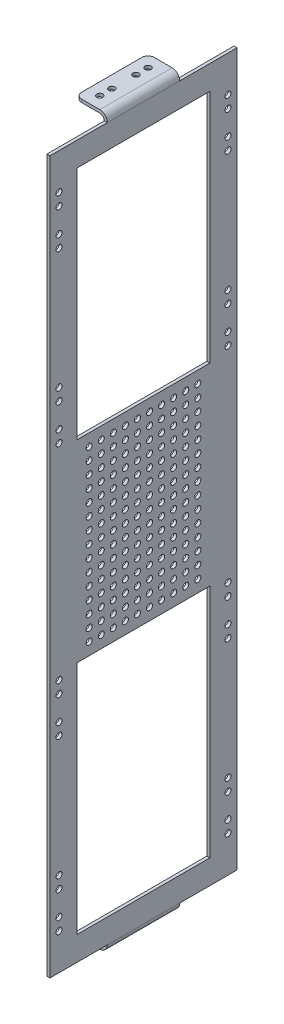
SolidWorks part; units mm, degrees
ref_plane "Front Plane" through (0, 0, 0) normal (0, 0, 1) x (1, 0, 0)
ref_plane "Top Plane" through (0, 0, 0) normal (0, 1, 0) x (1, 0, 0)
ref_plane "Right Plane" through (0, 0, 0) normal (1, 0, 0) x (0, 0, -1)
sketch "Sketch1" plane through (0, 0, 0) normal (1, 0, 0) x (0, 0, -1)
  line L1 (0, 0) -> (95.25, 0)
  line L2 (0, 0) -> (0, 374.65)
  line L3 (0, 374.65) -> (95.25, 374.65)
  line L4 (95.25, 0) -> (95.25, 374.65)
  dimension "D1" = 95.25
  dimension "D2" = 374.65
extrude "MainPlateExtrude" add sketch "Sketch1" along normal blind 1.5875
sketch "Sketch4" plane through (0, 0, 0) normal (-1, 0, 0) x (0, 0, 1)
  line L0 (-82.55, 12.7) -> (-82.55, 361.95)
  line L1 (-95.25, 0) -> (0, 0) construction
  line L2 (-95.25, 0) -> (-95.25, 374.65) construction
  line L3 (-95.25, 374.65) -> (0, 374.65) construction
  line L4 (0, 0) -> (0, 374.65) construction
  line L5 (-82.55, 361.95) -> (-12.7, 361.95)
  line L6 (-12.7, 12.7) -> (-12.7, 361.95)
  line L7 (-82.55, 12.7) -> (-12.7, 12.7)
  dimension "D1" = 12.7
extrude "WallOpening" cut sketch "Sketch4" against normal blind 1.5875
sketch "Sketch5" plane through (0, 0, 0) normal (-1, 0, 0) x (0, 0, 1)
  line L0 (-95.25, 187.325) -> (0, 187.325) construction
  line L1 (-95.25, 0) -> (-95.25, 374.65) construction
  line L2 (0, 374.65) -> (0, 0) construction
  line L3 (-82.55, 361.95) -> (-82.55, 12.7) construction
  line L4 (-82.55, 238.125) -> (-12.7, 238.125)
  line L5 (-82.55, 238.125) -> (-82.55, 136.525)
  line L6 (-82.55, 136.525) -> (-12.7, 136.525)
  line L7 (-12.7, 238.125) -> (-12.7, 136.525)
  line L8 (-12.7, 12.7) -> (-12.7, 361.95) construction
  circle A0 centre (-76.2, 231.775) radius 1.5875
  circle A1 centre (-69.85, 231.775) radius 1.5875
  circle A2 centre (-63.5, 231.775) radius 1.5875
  circle A3 centre (-57.15, 231.775) radius 1.5875
  circle A4 centre (-50.8, 231.775) radius 1.5875
  circle A5 centre (-44.45, 231.775) radius 1.5875
  circle A6 centre (-38.1, 231.775) radius 1.5875
  circle A7 centre (-31.75, 231.775) radius 1.5875
  circle A8 centre (-25.4, 231.775) radius 1.5875
  circle A9 centre (-19.05, 231.775) radius 1.5875
  circle A10 centre (-69.85, 225.425) radius 1.5875
  circle A11 centre (-63.5, 225.425) radius 1.5875
  circle A12 centre (-57.15, 225.425) radius 1.5875
  circle A13 centre (-50.8, 225.425) radius 1.5875
  circle A14 centre (-44.45, 225.425) radius 1.5875
  circle A15 centre (-38.1, 225.425) radius 1.5875
  circle A16 centre (-31.75, 225.425) radius 1.5875
  circle A17 centre (-25.4, 225.425) radius 1.5875
  circle A18 centre (-19.05, 225.425) radius 1.5875
  circle A19 centre (-69.85, 219.075) radius 1.5875
  circle A20 centre (-63.5, 219.075) radius 1.5875
  circle A21 centre (-57.15, 219.075) radius 1.5875
  circle A22 centre (-50.8, 219.075) radius 1.5875
  circle A23 centre (-44.45, 219.075) radius 1.5875
  circle A24 centre (-38.1, 219.075) radius 1.5875
  circle A25 centre (-31.75, 219.075) radius 1.5875
  circle A26 centre (-25.4, 219.075) radius 1.5875
  circle A27 centre (-19.05, 219.075) radius 1.5875
  circle A28 centre (-69.85, 212.725) radius 1.5875
  circle A29 centre (-63.5, 212.725) radius 1.5875
  circle A30 centre (-57.15, 212.725) radius 1.5875
  circle A31 centre (-50.8, 212.725) radius 1.5875
  circle A32 centre (-44.45, 212.725) radius 1.5875
  circle A33 centre (-38.1, 212.725) radius 1.5875
  circle A34 centre (-31.75, 212.725) radius 1.5875
  circle A35 centre (-25.4, 212.725) radius 1.5875
  circle A36 centre (-19.05, 212.725) radius 1.5875
  circle A37 centre (-69.85, 206.375) radius 1.5875
  circle A38 centre (-63.5, 206.375) radius 1.5875
  circle A39 centre (-57.15, 206.375) radius 1.5875
  circle A40 centre (-50.8, 206.375) radius 1.5875
  circle A41 centre (-44.45, 206.375) radius 1.5875
  circle A42 centre (-38.1, 206.375) radius 1.5875
  circle A43 centre (-31.75, 206.375) radius 1.5875
  circle A44 centre (-25.4, 206.375) radius 1.5875
  circle A45 centre (-19.05, 206.375) radius 1.5875
  circle A46 centre (-69.85, 200.025) radius 1.5875
  circle A47 centre (-63.5, 200.025) radius 1.5875
  circle A48 centre (-57.15, 200.025) radius 1.5875
  circle A49 centre (-50.8, 200.025) radius 1.5875
  circle A50 centre (-44.45, 200.025) radius 1.5875
  circle A51 centre (-38.1, 200.025) radius 1.5875
  circle A52 centre (-31.75, 200.025) radius 1.5875
  circle A53 centre (-25.4, 200.025) radius 1.5875
  circle A54 centre (-19.05, 200.025) radius 1.5875
  circle A55 centre (-69.85, 193.675) radius 1.5875
  circle A56 centre (-63.5, 193.675) radius 1.5875
  circle A57 centre (-57.15, 193.675) radius 1.5875
  circle A58 centre (-50.8, 193.675) radius 1.5875
  circle A59 centre (-44.45, 193.675) radius 1.5875
  circle A60 centre (-38.1, 193.675) radius 1.5875
  circle A61 centre (-31.75, 193.675) radius 1.5875
  circle A62 centre (-25.4, 193.675) radius 1.5875
  circle A63 centre (-19.05, 193.675) radius 1.5875
  circle A64 centre (-69.85, 187.325) radius 1.5875
  circle A65 centre (-63.5, 187.325) radius 1.5875
  circle A66 centre (-57.15, 187.325) radius 1.5875
  circle A67 centre (-50.8, 187.325) radius 1.5875
  circle A68 centre (-44.45, 187.325) radius 1.5875
  circle A69 centre (-38.1, 187.325) radius 1.5875
  circle A70 centre (-31.75, 187.325) radius 1.5875
  circle A71 centre (-25.4, 187.325) radius 1.5875
  circle A72 centre (-19.05, 187.325) radius 1.5875
  circle A73 centre (-69.85, 180.975) radius 1.5875
  circle A74 centre (-63.5, 180.975) radius 1.5875
  circle A75 centre (-57.15, 180.975) radius 1.5875
  circle A76 centre (-50.8, 180.975) radius 1.5875
  circle A77 centre (-44.45, 180.975) radius 1.5875
  circle A78 centre (-38.1, 180.975) radius 1.5875
  circle A79 centre (-31.75, 180.975) radius 1.5875
  circle A80 centre (-25.4, 180.975) radius 1.5875
  circle A81 centre (-19.05, 180.975) radius 1.5875
  circle A82 centre (-69.85, 174.625) radius 1.5875
  circle A83 centre (-63.5, 174.625) radius 1.5875
  circle A84 centre (-57.15, 174.625) radius 1.5875
  circle A85 centre (-50.8, 174.625) radius 1.5875
  circle A86 centre (-44.45, 174.625) radius 1.5875
  circle A87 centre (-38.1, 174.625) radius 1.5875
  circle A88 centre (-31.75, 174.625) radius 1.5875
  circle A89 centre (-25.4, 174.625) radius 1.5875
  circle A90 centre (-19.05, 174.625) radius 1.5875
  circle A91 centre (-69.85, 168.275) radius 1.5875
  circle A92 centre (-63.5, 168.275) radius 1.5875
  circle A93 centre (-57.15, 168.275) radius 1.5875
  circle A94 centre (-50.8, 168.275) radius 1.5875
  circle A95 centre (-44.45, 168.275) radius 1.5875
  circle A96 centre (-38.1, 168.275) radius 1.5875
  circle A97 centre (-31.75, 168.275) radius 1.5875
  circle A98 centre (-25.4, 168.275) radius 1.5875
  circle A99 centre (-19.05, 168.275) radius 1.5875
  circle A100 centre (-69.85, 161.925) radius 1.5875
  circle A101 centre (-63.5, 161.925) radius 1.5875
  circle A102 centre (-57.15, 161.925) radius 1.5875
  circle A103 centre (-50.8, 161.925) radius 1.5875
  circle A104 centre (-44.45, 161.925) radius 1.5875
  circle A105 centre (-38.1, 161.925) radius 1.5875
  circle A106 centre (-31.75, 161.925) radius 1.5875
  circle A107 centre (-25.4, 161.925) radius 1.5875
  circle A108 centre (-19.05, 161.925) radius 1.5875
  circle A109 centre (-69.85, 155.575) radius 1.5875
  circle A110 centre (-63.5, 155.575) radius 1.5875
  circle A111 centre (-57.15, 155.575) radius 1.5875
  circle A112 centre (-50.8, 155.575) radius 1.5875
  circle A113 centre (-44.45, 155.575) radius 1.5875
  circle A114 centre (-38.1, 155.575) radius 1.5875
  circle A115 centre (-31.75, 155.575) radius 1.5875
  circle A116 centre (-25.4, 155.575) radius 1.5875
  circle A117 centre (-19.05, 155.575) radius 1.5875
  circle A118 centre (-69.85, 149.225) radius 1.5875
  circle A119 centre (-63.5, 149.225) radius 1.5875
  circle A120 centre (-57.15, 149.225) radius 1.5875
  circle A121 centre (-50.8, 149.225) radius 1.5875
  circle A122 centre (-44.45, 149.225) radius 1.5875
  circle A123 centre (-38.1, 149.225) radius 1.5875
  circle A124 centre (-31.75, 149.225) radius 1.5875
  circle A125 centre (-25.4, 149.225) radius 1.5875
  circle A126 centre (-19.05, 149.225) radius 1.5875
  circle A127 centre (-69.85, 142.875) radius 1.5875
  circle A128 centre (-63.5, 142.875) radius 1.5875
  circle A129 centre (-57.15, 142.875) radius 1.5875
  circle A130 centre (-50.8, 142.875) radius 1.5875
  circle A131 centre (-44.45, 142.875) radius 1.5875
  circle A132 centre (-38.1, 142.875) radius 1.5875
  circle A133 centre (-31.75, 142.875) radius 1.5875
  circle A134 centre (-25.4, 142.875) radius 1.5875
  circle A135 centre (-19.05, 142.875) radius 1.5875
  circle A136 centre (-76.2, 225.425) radius 1.5875
  circle A137 centre (-76.2, 219.075) radius 1.5875
  circle A138 centre (-76.2, 212.725) radius 1.5875
  circle A139 centre (-76.2, 206.375) radius 1.5875
  circle A140 centre (-76.2, 200.025) radius 1.5875
  circle A141 centre (-76.2, 193.675) radius 1.5875
  circle A142 centre (-76.2, 187.325) radius 1.5875
  circle A143 centre (-76.2, 180.975) radius 1.5875
  circle A144 centre (-76.2, 174.625) radius 1.5875
  circle A145 centre (-76.2, 168.275) radius 1.5875
  circle A146 centre (-76.2, 161.925) radius 1.5875
  circle A147 centre (-76.2, 155.575) radius 1.5875
  circle A148 centre (-76.2, 149.225) radius 1.5875
  circle A149 centre (-76.2, 142.875) radius 1.5875
  dimension "D3" = 3.175
  dimension "D1" = 50.8
  dimension "D2" = 50.8
  dimension "D4" = 6.35
  dimension "D5" = 6.35
  dimension "D6" = 10
  dimension "D7" = 15
extrude "AntennaeMount" add sketch "Sketch5" against normal blind 1.5875
ref_plane "Plane1" through (0, 0, -47.625) normal (0, 0, -1) x (-1, 0, 0)
sketch "Sketch7" plane through (0, 0, -47.625) normal (0, 0, -1) x (-1, 0, 0)
  line L0 (-1.5875, 374.65) -> (0, 374.65) construction
  line L1 (-1.5875, 374.65) -> (0, 374.65) construction
  line L2 (2.3813, 377.0312) -> (2.3813, 374.65) construction
  line L3 (2.3813, 374.65) -> (-1.5875, 374.65) construction
  line L4 (0, 374.65) -> (-1.5875, 374.65)
  line L6 (2.3813, 378.6187) -> (15.0812, 378.6187)
  line L8 (2.3813, 377.0312) -> (15.0812, 377.0312)
  line L9 (15.0812, 378.6187) -> (15.0812, 377.0312)
  arc A0 (-1.5875, 374.65) -> (2.3813, 378.6187) centre (2.3813, 374.65) cw
  arc A1 (0, 374.65) -> (2.3813, 377.0312) centre (2.3813, 374.65) cw
  dimension "D1" = 3.9688
  dimension "D3" = 2.3813
  dimension "D2" = 1.5875
  dimension "D4" = 12.7
extrude "Boss-Extrude1" add sketch "Sketch7" along normal blind 19.05
mirror "Mirror1" about plane through (0, 0, -47.625) normal (0, 0, -1) of "Boss-Extrude1"
ref_plane "Plane2" through (0, 187.325, 0) normal (0, 1, 0) x (1, 0, 0)
mirror "Mirror2" about plane through (0, 187.325, 0) normal (0, 1, 0) of "Mirror1", "Boss-Extrude1"
fillet "Fillet1" radius 3.175 4 edges at (-15.0812, 377.825, -28.575) (-15.0812, 377.825, -66.675) (-15.0812, -3.175, -28.575) (-15.0812, -3.175, -66.675)
sketch "Sketch8" plane through (0, 378.6187, 0) normal (0, 1, 0) x (1, 0, 0)
  line L0 (-15.0812, 47.625) -> (-2.3813, 47.625) construction
  line L1 (-15.0812, 63.5) -> (-15.0812, 31.75) construction
  line L2 (-2.3813, 66.675) -> (-2.3813, 28.575) construction
  line L3 (-8.7313, 47.625) -> (-8.7313, 66.675) construction
  line L4 (-11.9062, 66.675) -> (-2.3813, 66.675) construction
  line L5 (-8.7313, 47.625) -> (-8.7313, 28.575) construction
  line L6 (-11.9062, 28.575) -> (-2.3813, 28.575) construction
  circle A0 centre (-8.7313, 34.925) radius 1.5875
  circle A1 centre (-8.7313, 41.275) radius 1.5875
  circle A2 centre (-8.7313, 53.975) radius 1.5875
  circle A3 centre (-8.7313, 60.325) radius 1.5875
  dimension "D1" = 3.175
  dimension "D2" = 3.175
  dimension "D3" = 3.175
  dimension "D4" = 3.175
  dimension "D5" = 6.35
  dimension "D6" = 6.35
  dimension "D7" = 6.35
  dimension "D8" = 6.35
extrude "Cut-Extrude1" cut sketch "Sketch8" against normal blind 382.905
sketch "Sketch9" plane through (1.5875, 0, 0) normal (1, 0, 0) x (0, 0, -1)
  line L0 (12.7, 361.95) -> (0, 361.95) construction
  line L1 (0, 374.65) -> (0, 0) construction
  line L2 (6.35, 361.95) -> (6.35, 374.65) construction
  line L3 (28.575, 374.65) -> (0, 374.65) construction
  line L4 (6.35, 361.95) -> (6.35, 0) construction
  line L5 (0, 0) -> (28.575, 0) construction
  line L6 (3.175, 355.6) -> (3.175, 349.25) construction
  line L7 (3.175, 349.25) -> (3.175, 336.55) construction
  line L8 (3.175, 336.55) -> (3.175, 330.2) construction
  line L9 (3.175, 330.2) -> (3.175, 266.7) construction
  line L10 (3.175, 241.3) -> (3.175, 133.35) construction
  line L11 (3.175, 107.95) -> (3.175, 44.45) construction
  circle A0 centre (3.175, 355.6) radius 1.5875
  circle A1 centre (3.175, 349.25) radius 1.5875
  circle A2 centre (3.175, 336.55) radius 1.5875
  circle A3 centre (3.175, 330.2) radius 1.5875
  circle A4 centre (3.175, 247.65) radius 1.5875
  circle A5 centre (3.175, 241.3) radius 1.5875
  circle A6 centre (3.175, 266.7) radius 1.5875
  circle A7 centre (3.175, 260.35) radius 1.5875
  circle A8 centre (3.175, 127) radius 1.5875
  circle A9 centre (3.175, 133.35) radius 1.5875
  circle A10 centre (3.175, 107.95) radius 1.5875
  circle A11 centre (3.175, 114.3) radius 1.5875
  circle A12 centre (3.175, 25.4) radius 1.5875
  circle A13 centre (3.175, 19.05) radius 1.5875
  circle A14 centre (3.175, 38.1) radius 1.5875
  circle A15 centre (3.175, 44.45) radius 1.5875
  dimension "D1" = 19.05
  dimension "D3" = 3.175
  dimension "D4" = 3.175
  dimension "D9" = 63.5
  dimension "D2" = 3.175
  dimension "D5" = 6.35
  dimension "D6" = 3.175
  dimension "D7" = 12.7
  dimension "D8" = 6.35
  dimension "D10" = 107.95
  dimension "D11" = 6.35
  dimension "D12" = 12.7
  dimension "D13" = 6.35
  dimension "D14" = 6.35
  dimension "D15" = 12.7
  dimension "D16" = 6.35
  dimension "D17" = 63.5
extrude "Cut-Extrude2" cut sketch "Sketch9" against normal blind 25.4
ref_plane "Plane3" through (0, 0, -47.625) normal (0, 0, 1) x (1, 0, 0)
mirror "Mirror3" about plane through (0, 0, -47.625) normal (0, 0, 1) of "Cut-Extrude2"
sketch "Sketch10" plane through (0, 0, 0) normal (0, 0, 1) x (1, 0, 0)
  line L1 (0, 374.65) -> (1.5875, 374.65)
  line L2 (0, 374.65) -> (0, 0)
  line L3 (0, 0) -> (1.5875, 0)
  line L4 (1.5875, 374.65) -> (1.5875, 0)
extrude "Boss-Extrude2" add sketch "Sketch10" along normal blind 1.5875
mirror "Mirror4" about plane through (0, 0, -47.625) normal (0, 0, 1) of "Boss-Extrude2"
